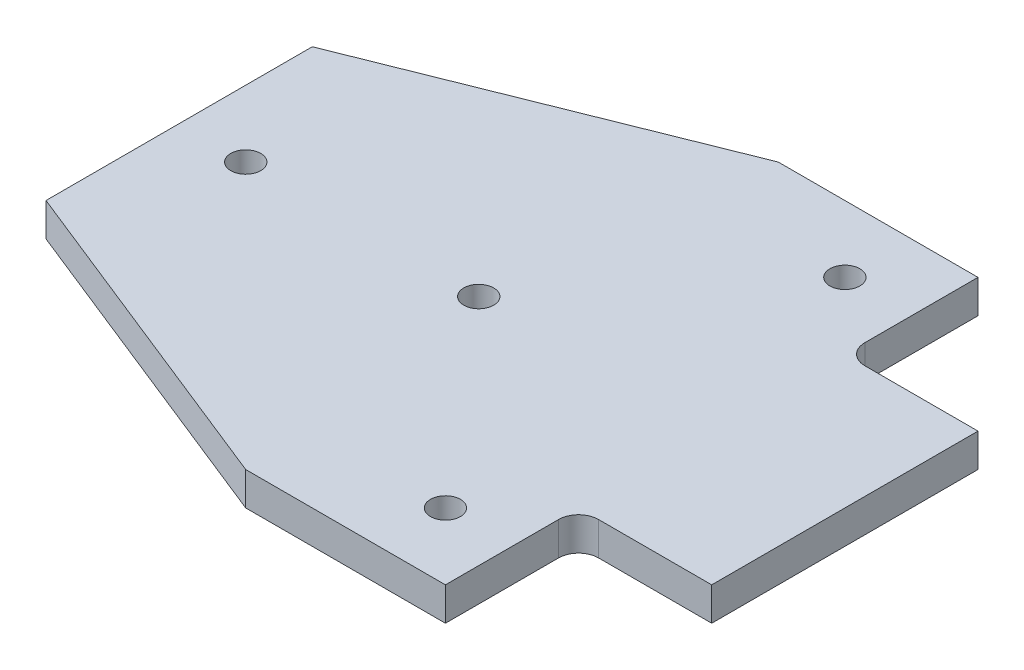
SolidWorks part; units mm, degrees
ref_plane "Front Plane" through (0, 0, 0) normal (0, 0, 1) x (1, 0, 0)
ref_plane "Top Plane" through (0, 0, 0) normal (0, 1, 0) x (1, 0, 0)
ref_plane "Right Plane" through (0, 0, 0) normal (1, 0, 0) x (0, 0, -1)
sketch "Sketch1" plane through (0, 0, 0) normal (0, 1, 0) x (1, 0, 0)
  line L0 (0, 0) -> (100, 0) construction
  line L1 (100, -20) -> (100, 20)
  line L2 (100, 20) -> (83, 20)
  line L3 (80, 23) -> (80, 40)
  line L4 (80, 40) -> (50, 40)
  line L5 (50, 40) -> (0, 20)
  line L6 (0, 20) -> (0, -20)
  line L7 (50, -40) -> (0, -20)
  line L8 (80, -40) -> (50, -40)
  line L9 (80, -23) -> (80, -40)
  line L10 (100, -20) -> (83, -20)
  arc A0 (83, 20) -> (80, 23) centre (83, 23) cw
  circle A1 centre (45, 0) radius 2.25
  circle A2 centre (10, 0) radius 2.25
  circle A3 centre (70, 30) radius 2.25
  circle A4 centre (70, -30) radius 2.25
  arc A5 (83, -20) -> (80, -23) centre (83, -23) ccw
  dimension "D1" = 3
  dimension "D8" = 4.5
  dimension "D9" = 4.5
  dimension "D10" = 4.5
  dimension "D11" = 10
  dimension "D12" = 35
  dimension "D13" = 10
  dimension "D14" = 10
  dimension "D2" = 20
  dimension "D3" = 20
  dimension "D4" = 20
  dimension "D5" = 30
  dimension "D6" = 50
  dimension "D7" = 20
extrude "Extrude1" add sketch "Sketch1" along normal blind 5
